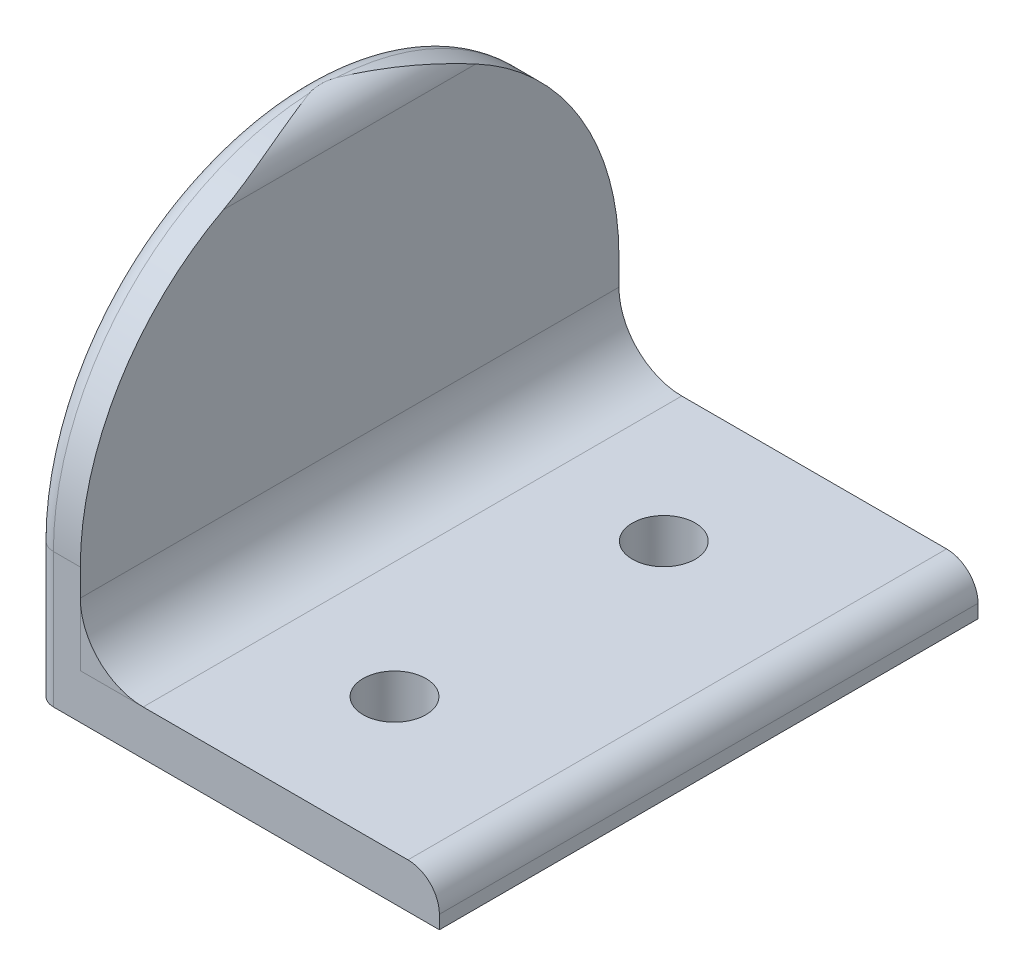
SolidWorks part; units mm, degrees
ref_plane "Plan de face" through (0, 0, 0) normal (0, 0, 1) x (1, 0, 0)
ref_plane "Plan de dessus" through (0, 0, 0) normal (0, 1, 0) x (1, 0, 0)
ref_plane "Plan de droite" through (0, 0, 0) normal (1, 0, 0) x (0, 0, -1)
imported_body "Importée1"
sketch "Esquisse1" plane through (0, 0, 0) normal (0, -1, 0) x (1, 0, 0)
  line L0 (0, 30) -> (45, 30) construction
  line L1 (45, 30) -> (45, -30) construction
  circle A0 centre (25, 15) radius 3.5
  circle A1 centre (25, -15) radius 3.5
  point P4 (22.5, 30)
  dimension "D1" = 7
  dimension "D2" = 7
  dimension "D3" = 30
  dimension "D4" = 15
  dimension "D5" = 20
extrude "Extrusion1" cut sketch "Esquisse1" against normal blind 10
sketch "Esquisse2" plane through (0, 0, 0) normal (-1, 0, 0) x (0, 0, 1)
  line L0 (30, 45) -> (-30, 45) construction
  line L2 (-30, 15) -> (-33.0099, 27.2629)
  line L3 (-33.0099, 27.2629) -> (-32.2554, 47.6347)
  line L4 (-32.2554, 47.6347) -> (31.4065, 47.6347)
  line L5 (31.4065, 47.6347) -> (32.444, 22.6415)
  line L6 (32.444, 22.6415) -> (30, 15)
  arc A0 (30, 15) -> (-30, 15) centre (0, 15) ccw
  dimension "D1" = 60
extrude "Extrusion3" cut sketch "Esquisse2" against normal through all
fillet "Congé1" radius 2 3 edges at (0, 7.5, -30) (0, 7.5, 30) (0, 45, 0)
